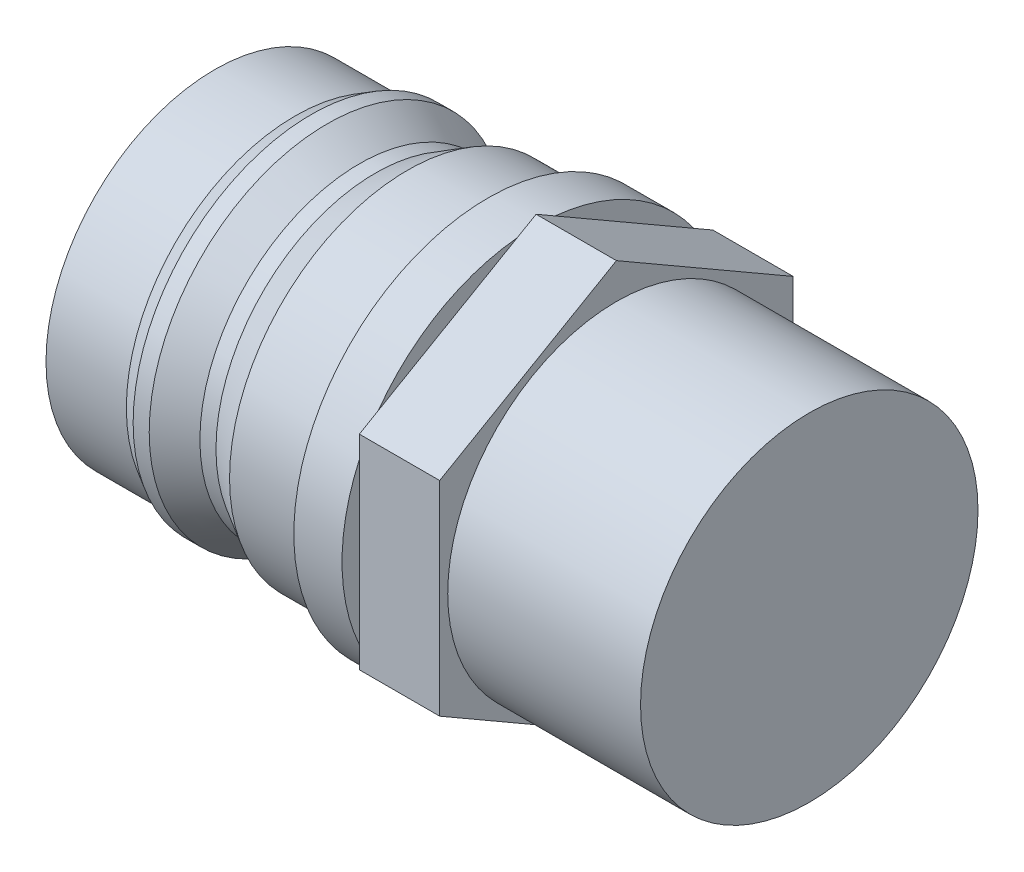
SolidWorks part; units mm, degrees
ref_plane "Alzado" through (0, 0, 0) normal (0, 0, 1) x (1, 0, 0)
ref_plane "Planta" through (0, 0, 0) normal (0, 1, 0) x (1, 0, 0)
ref_plane "Vista lateral" through (0, 0, 0) normal (1, 0, 0) x (0, 0, -1)
sketch "Croquis1" plane through (0, 0, 0) normal (0, 0, 1) x (1, 0, 0)
  line L0 (0, 0) -> (20, 0) construction
  line L1 (0, 0) -> (0, 10.5)
  line L2 (0, 10.5) -> (5, 10.5)
  line L3 (5, 10.5) -> (6, 11.0774)
  line L4 (6, 11.0774) -> (7, 11.0774)
  line L5 (6.5, 11.0774) -> (6.5, 0) construction
  line L6 (8, 10.5) -> (7, 11.0774)
  line L7 (8, 10.5) -> (9, 9.9226)
  line L8 (9, 9.9226) -> (10, 9.9226)
  line L9 (9.5, 9.9226) -> (9.5, 0) construction
  line L10 (11, 10.5) -> (10, 9.9226)
  line L11 (11, 10.5) -> (12, 11.0774)
  line L12 (12, 11.0774) -> (17, 11.0774)
  line L14 (20, 0) -> (0, 0)
  line L15 (17, 11.0774) -> (17, 12.0774)
  line L16 (17, 12.0774) -> (20, 12.0774)
  line L17 (20, 12.0774) -> (20, 0)
  point P18 (27.5743, 0)
  dimension "D1" = 21
  dimension "D2" = 5
  dimension "D3" = 1
  dimension "D4" = 1
  dimension "D5" = 150
  dimension "D6" = 1
  dimension "D7" = 1
  dimension "D8" = 5
  dimension "D9" = 1
  dimension "D10" = 3
revolve "Revolución1" add sketch "Croquis1" angle 360 about L14
sketch "Croquis8" plane through (20, 0, 0) normal (1, 0, 0) x (0, 0, -1)
  line L1 (0, 12.7017) -> (-11, 6.3509)
  line L2 (-11, 6.3509) -> (-11, -6.3509)
  line L3 (-11, -6.3509) -> (0, -12.7017)
  line L4 (0, -12.7017) -> (11, -6.3509)
  line L5 (11, -6.3509) -> (11, 6.3509)
  line L6 (11, 6.3509) -> (0, 12.7017)
  circle A0 centre (0, 0) radius 11 construction
  dimension "D1" = 22
extrude "Saliente-Extruir6" add sketch "Croquis8" along normal blind 5
sketch "Croquis11" plane through (0, 0, 0) normal (0, 0, 1) x (1, 0, 0)
  line L0 (25, 0) -> (52.1801, 0) construction
  line L1 (25, 6.3509) -> (25, -6.3509) construction
  line L2 (25, 0) -> (25, 10.5)
  line L3 (25, 10.5) -> (37, 10.5)
  line L4 (37, 10.5) -> (37, 0)
  line L5 (37, 0) -> (25, 0)
  dimension "D1" = 21
  dimension "D2" = 12
revolve "Revolución4" add sketch "Croquis11" angle 360 about L0
